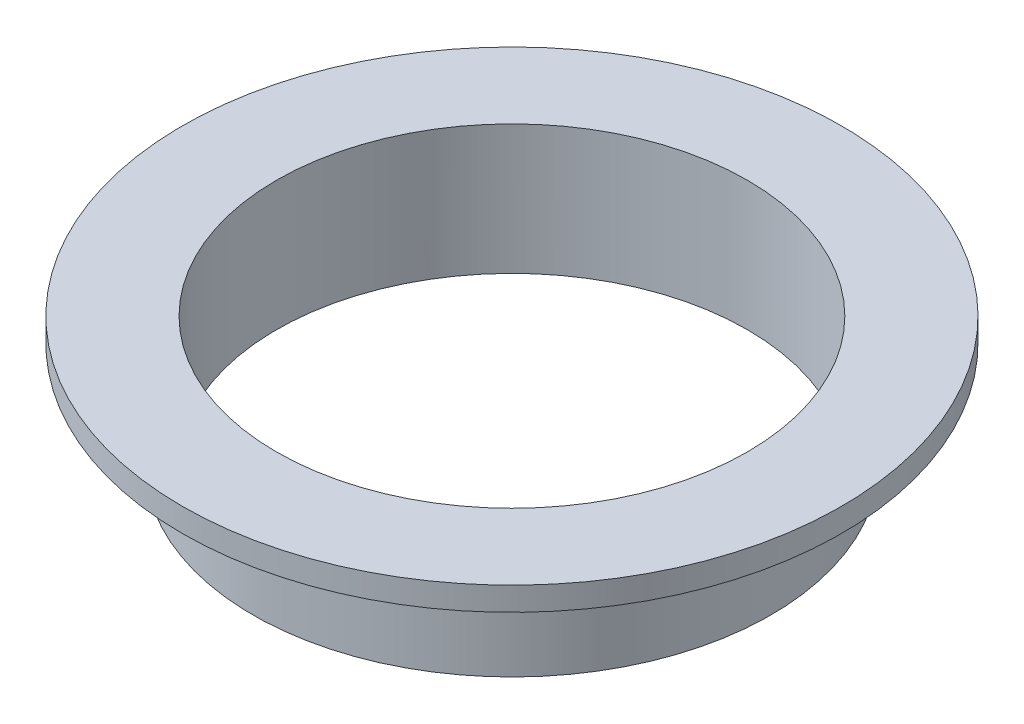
SolidWorks part; units mm, degrees
ref_plane "Alzado" through (0, 0, 0) normal (0, 0, 1) x (1, 0, 0)
ref_plane "Planta" through (0, 0, 0) normal (0, 1, 0) x (1, 0, 0)
ref_plane "Vista lateral" through (0, 0, 0) normal (1, 0, 0) x (0, 0, -1)
sketch "Croquis1" plane through (0, 0, 0) normal (0, 1, 0) x (1, 0, 0)
  circle A0 centre (0, 0) radius 28
  dimension "D1" = 56
extrude "Saliente-Extruir1" add sketch "Croquis1" along normal blind 2
sketch "Croquis2" plane through (0, 0, 0) normal (0, -1, 0) x (1, 0, 0)
  circle A0 centre (0, 0) radius 22
  dimension "D1" = 44
extrude "Saliente-Extruir2" add sketch "Croquis2" along normal blind 9
sketch "Croquis3" plane through (0, -9, 0) normal (0, -1, 0) x (1, 0, 0)
  circle A0 centre (0, 0) radius 20
  dimension "D1" = 40
extrude "Cortar-Extruir1" cut sketch "Croquis3" against normal blind 36
